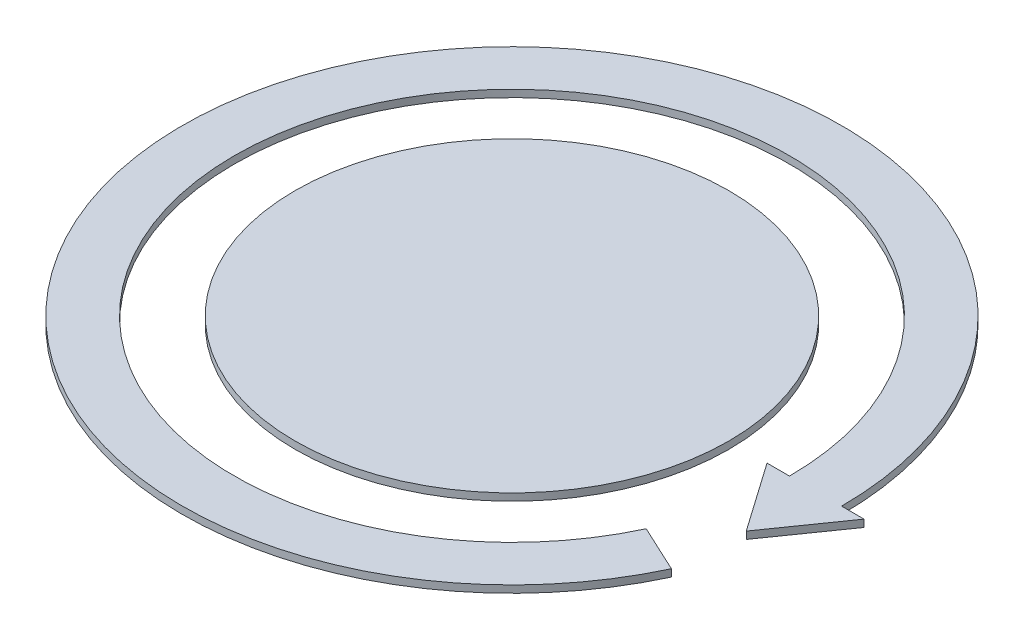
SolidWorks part; units mm, degrees
ref_plane "Ebene vorne" through (0, 0, 0) normal (0, 0, 1) x (1, 0, 0)
ref_plane "Ebene oben" through (0, 0, 0) normal (0, 1, 0) x (1, 0, 0)
ref_plane "Ebene rechts" through (0, 0, 0) normal (1, 0, 0) x (0, 0, -1)
sketch "Skizze1" plane through (0, 0, 0) normal (0, 1, 0) x (1, 0, 0)
  line L0 (82.2927, -38.3737) -> (69.2872, -32.3092)
  line L1 (70.2656, 0) -> (76.45, 0)
  line L2 (90.8, 0) -> (96.9844, 0)
  line L3 (96.9844, 0) -> (83.625, -19.0792)
  line L4 (83.625, -19.0792) -> (70.2656, 0)
  circle A0 centre (0, 0) radius 59.75
  arc A1 (76.45, 0) -> (69.2872, -32.3092) centre (0, 0) ccw
  arc A2 (90.8, 0) -> (82.2927, -38.3737) centre (0, 0) ccw
  arc A3 (76.0087, -8.2021) -> (76.45, 0) centre (0, 0) ccw construction
  arc A4 (90.2962, -9.5518) -> (90.8, 0) centre (0, 0) ccw construction
  arc A5 (69.2872, -32.3092) -> (76.0087, -8.2021) centre (0, 0) ccw construction
  arc A6 (82.2927, -38.3737) -> (90.2962, -9.5518) centre (0, 0) ccw construction
  point P16 (0, 0)
  point P19 (73.3578, 0)
  point P20 (0, 0)
  dimension "D1" = 119.5
  dimension "D2" = 152.9
  dimension "D3" = 181.6
  dimension "D4" = 73.3578
  dimension "D5" = 25
  dimension "D6" = 125
  dimension "D7" = 125
extrude "Aufsatz-Linear austragen1" add sketch "Skizze1" along normal blind 2
